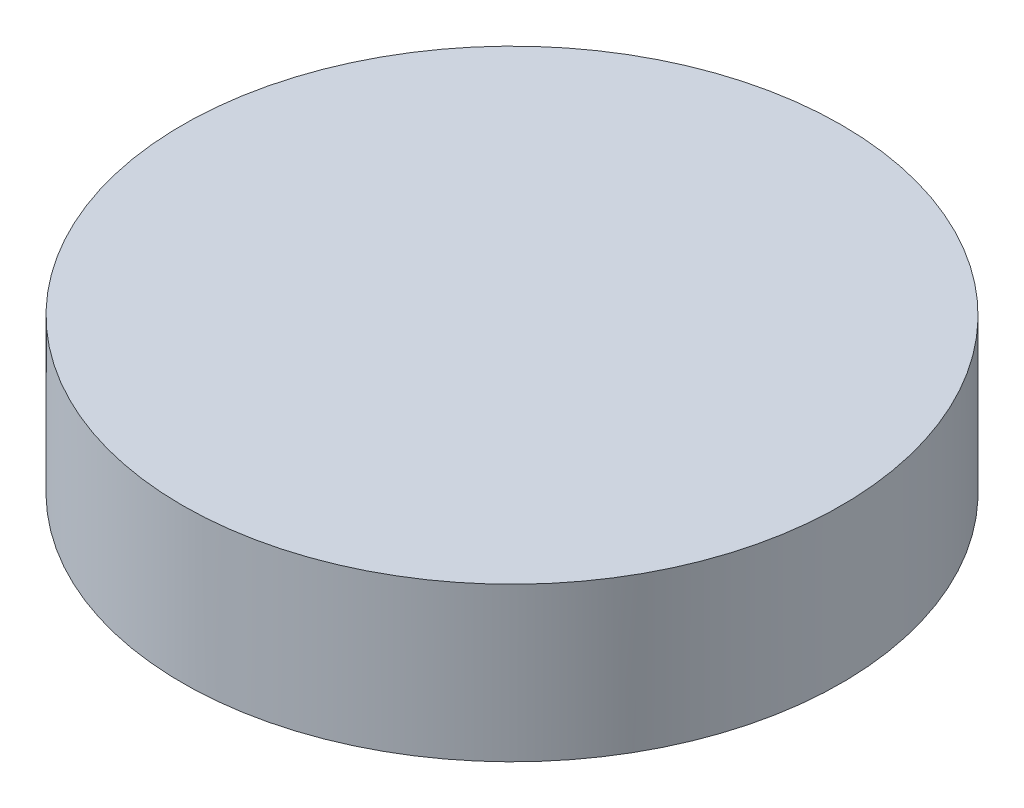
SolidWorks part; units mm, degrees
ref_plane "Front Plane" through (0, 0, 0) normal (0, 0, 1) x (1, 0, 0)
ref_plane "Top Plane" through (0, 0, 0) normal (0, 1, 0) x (1, 0, 0)
ref_plane "Right Plane" through (0, 0, 0) normal (1, 0, 0) x (0, 0, -1)
sketch "Sketch1" plane through (0, 0, 0) normal (0, 1, 0) x (1, 0, 0)
  circle A0 centre (0, 0) radius 15
extrude "Boss-Extrude1" add sketch "Sketch1" along normal blind 5
sketch "Sketch5" plane through (0, 0, 0) normal (0, -1, 0) x (1, 0, 0)
  line L37 (-18.2205, 8.8545) -> (-18.2205, -10.9402) construction
  line L38 (-1.4814, -1.8316) -> (-1.6632, -2.935) construction
  line L39 (-1.0151, 0.9979) -> (-1.3587, -1.0871) construction
  line L40 (0.0081, -1.7512) -> (-6.9181, -0.61) construction
  line L41 (0.559, 0) -> (-1.6166, 0.3585) construction
  line L42 (-1.687, -0.0688) -> (-1.8416, -1.0075)
  line L43 (-0.7211, -0.228) -> (-0.8757, -1.1667)
  line L44 (-1.5462, 0.7858) -> (-2.3697, 0.9215)
  line L45 (-1.687, -0.0688) -> (-2.4266, 0.053)
  line L46 (-1.8416, -1.0075) -> (-2.7822, -0.8525)
  line L47 (-3.4129, -0.7486) -> (-6.8477, -0.1827)
  line L48 (-3.0198, 0.1508) -> (-4.572, 0.4065)
  line L49 (-2.9824, 1.0224) -> (-4.6964, 1.3049)
  line L50 (-5.3138, 1.4066) -> (-6.2967, 1.5686)
  line L51 (-5.1876, 0.508) -> (-6.4376, 0.7139)
  line L52 (-5.249, -1.3239) -> (-6.9885, -1.0373)
  line L53 (-3.8876, -1.5482) -> (-4.6564, -1.4216)
  line L54 (-1.9825, -1.8622) -> (-3.2563, -1.6523)
  line L55 (-1.9825, -1.8622) -> (-2.1461, -2.8555)
  line L56 (4.2263, -2.2789) -> (1.9214, -4.0838)
  line L57 (3.8607, -1.3299) -> (1.3217, -3.3181)
  line L58 (4.8771, -1.7693) -> (5.4141, -3.1636)
  line L59 (4.2263, -2.2789) -> (4.6764, -3.4477)
  line L60 (-0.5322, 0.9184) -> (-0.5802, 0.6266)
  line L61 (-1.4981, 1.0775) -> (-1.5462, 0.7858)
  line L62 (8.6507, 1.1857) -> (4.8771, -1.7693)
  line L63 (8.0511, 1.9514) -> (4.5116, -0.8202)
  line L64 (3.8545, 0.8859) -> (4.5116, -0.8202)
  line L65 (3.171, 2.6607) -> (3.5292, 1.7306)
  line L66 (2.4333, 2.3765) -> (3.8607, -1.3299)
  line L67 (-1.0165, -2.0213) -> (-1.1802, -3.0146)
  line L68 (-0.0624, -2.1785) -> (-1.0165, -2.0213)
  line L69 (0.0785, -1.3239) -> (-0.8757, -1.1667)
  line L70 (0.4886, -0.4273) -> (-0.7211, -0.228)
  line L71 (0.6294, 0.4273) -> (-0.5802, 0.6266)
  line L72 (6.2652, -6.1784) -> (-7.205, -4.0838) construction
  line L73 (6.3333, -5.7403) -> (-7.1368, -3.6456)
  line L74 (6.1971, -6.6166) -> (-7.2731, -4.522)
  circle A0 centre (0, 0) radius 15
  circle A1 centre (0, 0) radius 13
  arc A23 (3.4796, 0.7595) -> (3.4054, 0.743) centre (2.9686, 2.8935) cw
  arc A24 (-7.205, -1.9798) -> (-7.6544, -2.3773) centre (-7.4297, -2.1785) ccw
  arc A25 (-1.1802, -3.0146) -> (-1.7234, -3.4208) centre (-1.6632, -2.935) cw
  arc A26 (-1.4981, 1.0775) -> (-0.5322, 0.9184) centre (-1.0151, 0.9979) cw
  circle A27 centre (-0.6609, 2.5186) radius 0.8053
  circle A28 centre (6.2652, 2.1806) radius 0.6408
  arc A29 (4.2338, 3.1505) -> (5.119, 3.3304) centre (4.6764, 3.2404) cw
  arc A30 (4.2338, 3.1505) -> (3.5292, 1.7306) centre (2.9686, 2.8935) cw
  arc A31 (5.119, 3.3304) -> (3.8545, 0.8859) centre (2.9686, 2.8935) cw
  arc A32 (-2.1513, -2.9712) -> (-2.1461, -2.8555) centre (-1.6632, -2.935) cw
  arc A33 (1.9214, -4.0838) -> (1.3217, -3.3181) centre (1.6215, -3.7009) cw
  arc A34 (8.0511, 1.9514) -> (8.6507, 1.1857) centre (8.3509, 1.5686) cw
  arc A35 (5.4141, -3.1636) -> (4.6764, -3.4477) centre (5.0453, -3.3057) cw
  arc A36 (2.4333, 2.3765) -> (3.171, 2.6607) centre (2.8021, 2.5186) cw
  arc A37 (-6.9885, -1.0373) -> (-6.8477, -0.1827) centre (-6.9181, -0.61) cw
  arc A38 (0.0785, -1.3239) -> (-0.0624, -2.1785) centre (0.0081, -1.7512) cw
  arc A39 (-6.4376, 0.7139) -> (-6.2967, 1.5686) centre (-6.3672, 1.1412) cw
  arc A40 (0.6294, 0.4273) -> (0.4886, -0.4273) centre (0.559, 0) cw
  arc A41 (6.3333, -5.7403) -> (6.1971, -6.6166) centre (6.2652, -6.1784) cw
  arc A42 (-7.2731, -4.522) -> (-7.1368, -3.6456) centre (-7.205, -4.0838) cw
  spline S10 degree 3 poles (-4.572, 0.4065) (-4.5418, 0.1224) (-4.5235, -0.2007) (-4.5398, -0.5414) (-4.541, -0.5627) knots 0.703072 0.703072 0.703072 0.703072 0.75 0.753128 0.753128 0.753128 0.753128
  spline S11 degree 3 poles (-5.1876, 0.508) (-5.1473, 0.1937) (-5.1226, -0.1223) (-5.137, -0.4645) knots 0.693045 0.693045 0.693045 0.693045 0.749636 0.749636 0.749636 0.749636
  spline S12 degree 3 poles (-5.249, -1.3239) (-5.2712, -1.4241) (-5.344, -1.7073) (-5.5048, -2.1232) (-5.7475, -2.4823) (-5.9968, -2.6517) (-6.2439, -2.6835) (-6.5801, -2.5496) (-6.9122, -2.2893) (-7.1154, -2.081) (-7.205, -1.9798) knots 0.795978 0.795978 0.795978 0.795978 0.8125 0.84375 0.875 0.90625 0.9375 0.96875 0.984375 1 1 1 1
  spline S13 degree 3 poles (-4.6564, -1.4216) (-4.6832, -1.5458) (-4.8219, -2.0931) (-5.1308, -2.7652) (-5.7536, -3.2366) (-6.3756, -3.2997) (-6.9009, -3.0627) (-7.3201, -2.7312) (-7.5505, -2.4948) (-7.6544, -2.3773) knots 0.794442 0.794442 0.794442 0.794442 0.8125 0.875 0.90625 0.9375 0.96875 0.984375 1 1 1 1
  spline S14 degree 3 poles (-2.7822, -0.8525) (-2.7312, -0.7591) (-2.5816, -0.4669) (-2.4756, -0.1622) (-2.4285, 0.0446) (-2.4266, 0.053) knots 0.266365 0.266365 0.266365 0.266365 0.28125 0.3125 0.313824 0.313824 0.313824 0.313824
  spline S15 degree 3 poles (-2.1513, -2.9712) (-2.1596, -2.9744) (-2.2883, -3.0212) (-2.6407, -3.0745) (-3.1936, -2.9648) (-3.5732, -2.7189) (-3.628, -2.5769) (-3.5695, -2.219) (-3.3827, -1.8677) (-3.2677, -1.6715) (-3.2563, -1.6523) knots 0.029037 0.029037 0.029037 0.029037 0.03125 0.0625 0.09375 0.125 0.15625 0.1875 0.21875 0.222132 0.222132 0.222132 0.222132
  spline S16 degree 3 poles (-3.4129, -0.7486) (-3.3265, -0.6008) (-3.154, -0.2853) (-3.0562, -0.0016) (-3.0198, 0.1508) knots 0.255756 0.255756 0.255756 0.255756 0.28125 0.311624 0.311624 0.311624 0.311624
  spline S17 degree 3 poles (-1.7234, -3.4208) (-1.8003, -3.4714) (-2.0986, -3.6155) (-2.6756, -3.6809) (-3.3866, -3.535) (-3.9982, -3.2145) (-4.2838, -2.5663) (-4.1292, -2.0212) (-3.9652, -1.6899) (-3.8876, -1.5482) knots 0.019454 0.019454 0.019454 0.019454 0.03125 0.0625 0.09375 0.125 0.15625 0.1875 0.211021 0.211021 0.211021 0.211021
  spline S18 degree 3 poles (-2.3697, 0.9215) (-2.3773, 1.0175) (-2.4366, 1.5083) (-2.6514, 2.2135) (-3.0718, 3.0301) (-3.5158, 3.4237) (-4.0277, 3.4737) (-4.4907, 3.345) (-5.0096, 2.9948) (-5.3641, 2.3174) (-5.3518, 1.7802) (-5.3242, 1.4965) (-5.3138, 1.4066) knots 0.359769 0.359769 0.359769 0.359769 0.375 0.4375 0.46875 0.5 0.515625 0.53125 0.5625 0.59375 0.625 0.640108 0.640108 0.640108 0.640108
  spline S19 degree 3 poles (-2.9824, 1.0224) (-2.9864, 1.0522) (-3.0159, 1.2456) (-3.1078, 1.6174) (-3.3096, 2.1924) (-3.5804, 2.6852) (-3.8015, 2.8478) (-3.9544, 2.863) (-4.2091, 2.8052) (-4.5645, 2.5521) (-4.7479, 2.2061) (-4.7534, 1.7643) (-4.716, 1.4475) (-4.6964, 1.3049) knots 0.369281 0.369281 0.369281 0.369281 0.375 0.40625 0.4375 0.46875 0.5 0.515625 0.53125 0.5625 0.59375 0.625 0.650567 0.650567 0.650567 0.650567
  text T0 "<b>.</b>" font "Engravers MT" height 2.4
  point P239 (-0.4699, -5.1311)
  point P244 (-1.3392, -0.9685)
  point P245 (4.4215, 1.9312)
  point P246 (4.9862, -1.0662)
  point P247 (3.9237, -0.3935)
  point P248 (-3.455, -1.1806)
  point P249 (-2.9041, 0.5706)
  dimension "D1" = 2
extrude "Boss-Extrude2" add sketch "Sketch5" along normal blind 2
sketch "Sketch6" plane through (0, 0, 0) normal (0, -1, 0) x (1, 0, 0)
  text T0 "<b>ENGR. IMAAD ULLAH KHAN YAMEEN</b>"
extrude "Boss-Extrude3" add sketch "Sketch6" along normal blind 2
